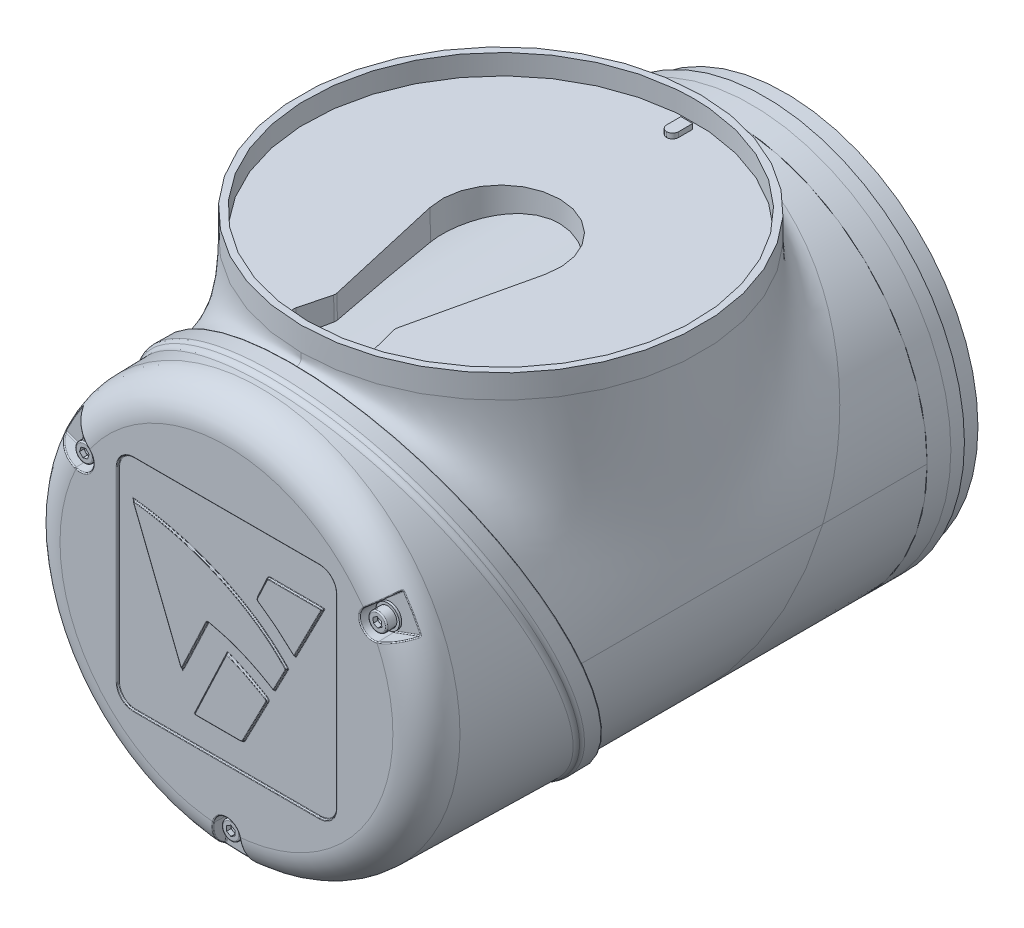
SolidWorks part; units mm, degrees
ref_plane "前视基准面" through (0, 0, 0) normal (0, 0, 1) x (1, 0, 0)
ref_plane "上视基准面" through (0, 0, 0) normal (0, 1, 0) x (1, 0, 0)
ref_plane "右视基准面" through (0, 0, 0) normal (1, 0, 0) x (0, 0, -1)
imported_body "GBT-SIZE3.01-T-0200_defeature-1-solid1"
imported_body "GBT-SIZE3.01-T-0200_defeature-1-solid2"
imported_body "SIZE3后盖组件-1-solid1"
sketch "草图2" plane through (0, 0, 0) normal (1, 0, 0) x (0, 0, -1)
  line L0 (74, 59) -> (74, -59) construction
  line L1 (67, 59) -> (74, 59)
  line L2 (67, 59) -> (67, 57)
  line L3 (67, 57) -> (74, 57)
  line L4 (74, 59) -> (74, 57)
  line L5 (67, 0) -> (67, 59) construction
  line L6 (0, 0) -> (98.1374, 0) construction
  dimension "D1" = 114
  dimension "D2" = 2
revolve "旋转1" add sketch "草图2" angle 360 about L6
